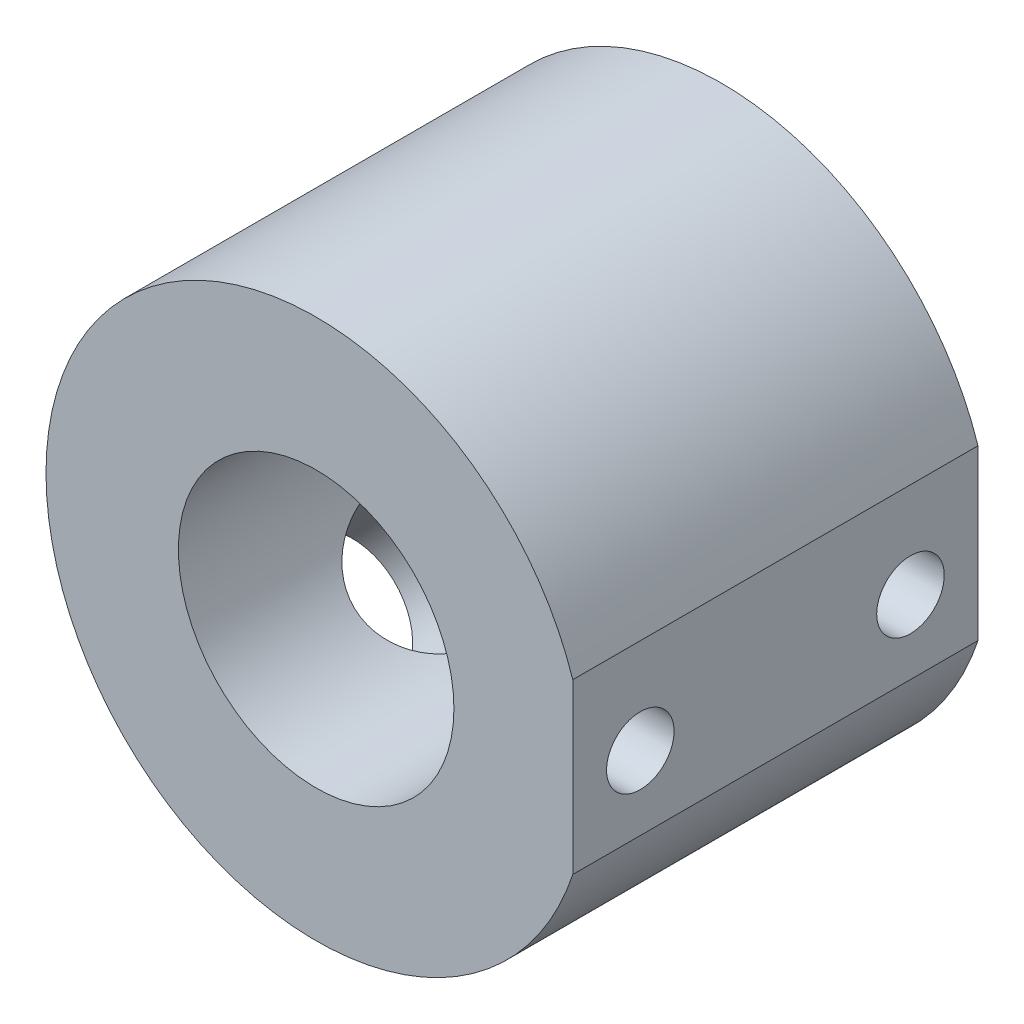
SolidWorks part; units mm, degrees
ref_plane "Face" through (0, 0, 0) normal (0, 0, 1) x (1, 0, 0)
ref_plane "Dessus" through (0, 0, 0) normal (0, 1, 0) x (1, 0, 0)
ref_plane "Droite" through (0, 0, 0) normal (1, 0, 0) x (0, 0, -1)
sketch "Esquisse1" plane through (0, 0, 0) normal (0, 0, 1) x (1, 0, 0)
  circle A0 centre (0, 0) radius 5.1
  circle A1 centre (0, 0) radius 10
  dimension "D1" = 10.2
  dimension "D2" = 20
extrude "Extrusion1" add sketch "Esquisse1" along normal mid plane 15
sketch "Esquisse2" plane through (0, 0, 0) normal (-1, 0, 0) x (0, 1, 0)
  circle A0 centre (-0.4011, 5) radius 1.25
  circle A1 centre (-0.4011, -5) radius 1.25
  dimension "D1" = 5
  dimension "D2" = 2.5
  dimension "D3" = 10
extrude "Enlèv. mat.-Extru.1" cut sketch "Esquisse2" against normal blind 10
sketch "Esquisse3" plane through (0, 0, 0) normal (0, 1, 0) x (1, 0, 0)
  line L0 (0, -14.9324) -> (0, 0.7312) construction
ref_plane "Plan1" through (0, 0, 0) normal (0.7071, 0.7071, 0) x (0, 0, -1)
sketch "Esquisse4" plane through (0, 0, 0) normal (0.7071, 0.7071, 0) x (0, 0, -1)
  line L0 (-14.9324, 0) -> (0.7312, 0) construction
  circle A0 centre (0, 0) radius 2.5
  dimension "D1" = 5
extrude "Enlèv. mat.-Extru.2" cut sketch "Esquisse4" against normal blind 20
sketch "Esquisse5" plane through (0, 0, 0) normal (0, 0, 1) x (1, 0, 0)
  line L0 (9.5, 8.2654) -> (9.5, -9.7682)
  spline_without_curve S0
  dimension "D1" = 9.5
extrude "Enlèv. mat.-Extru.3" cut sketch "Esquisse5" against normal mid plane 30
